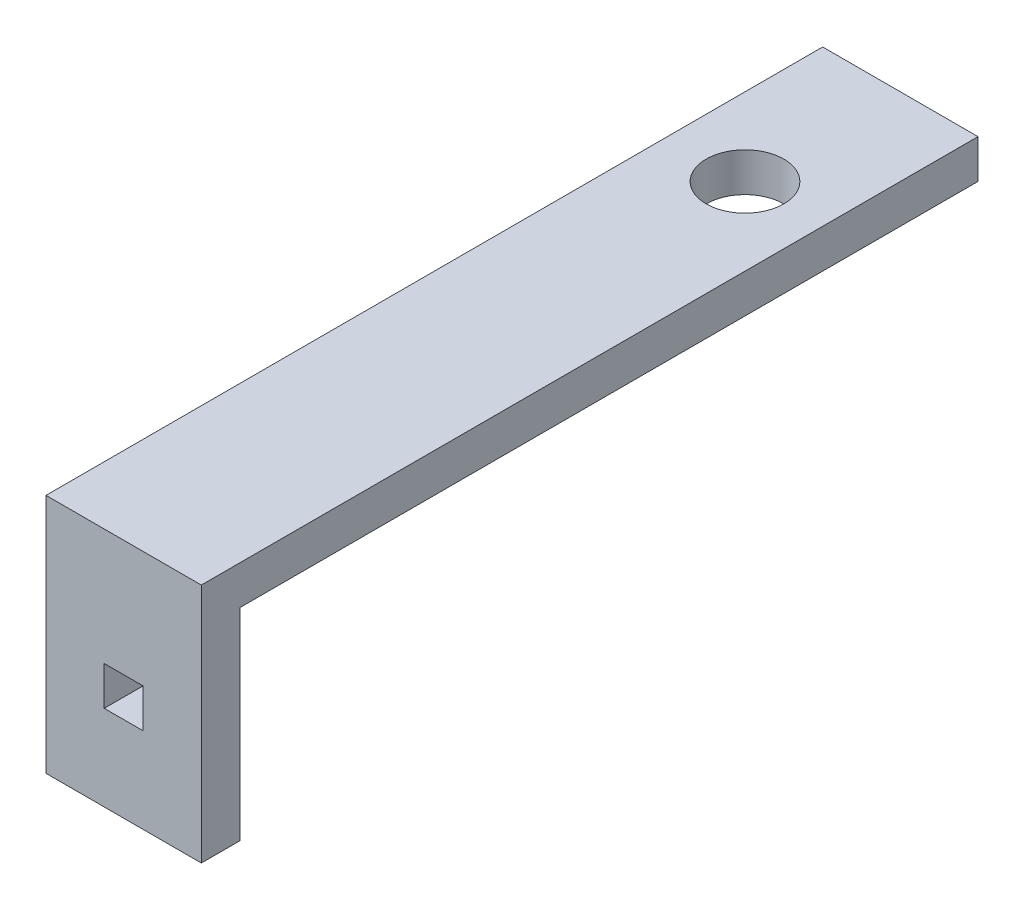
SolidWorks part; units mm, degrees
ref_plane "Front" through (0, 0, 0) normal (0, 0, 1) x (1, 0, 0)
ref_plane "Top" through (0, 0, 0) normal (0, 1, 0) x (1, 0, 0)
ref_plane "Right" through (0, 0, 0) normal (1, 0, 0) x (0, 0, -1)
ref_plane "Plane1" through (12.8097, 0, 0) normal (1, 0, 0) x (0, 0, -1)
sketch "Sketch2" plane through (12.8097, 0, 0) normal (1, 0, 0) x (0, 0, -1)
  line L12 (-24.1608, 8.3082) -> (70.8392, 8.3082)
  line L13 (-24.1608, -17.6911) -> (-24.1608, 8.3082)
  line L14 (-29.1608, -17.6911) -> (-24.1608, -17.6911)
  line L15 (-29.1608, 13.3082) -> (-29.1608, -17.6911)
  line L16 (70.8392, 13.3082) -> (-29.1608, 13.3082)
  line L17 (70.8392, 8.3082) -> (70.8392, 13.3082)
  dimension "D1" = 5
  dimension "D2" = 30.9992
  dimension "D3" = 100
extrude "Boss-Extrude1" add sketch "Sketch2" along normal blind 20 separate body
sketch "Sketch3" plane through (0, 13.3082, 0) normal (0, 1, 0) x (1, 0, 0)
  line L0 (32.8097, 70.8392) -> (12.8097, 70.8392) construction
  circle A0 centre (22.8097, 50.8392) radius 5
  dimension "D2" = 10
  dimension "D1" = 20
  dimension "D3" = 10
extrude "Cut-Extrude1" cut sketch "Sketch3" against normal up to next
sketch "Sketch4" plane through (0, 0, 29.1608) normal (0, 0, 1) x (1, 0, 0)
  line L0 (32.8097, -17.6911) -> (12.8097, -17.6911) construction
  line L1 (20.3097, -1.6911) -> (25.3097, -1.6911)
  line L2 (20.3097, -1.6911) -> (20.3097, -6.6911)
  line L3 (20.3097, -6.6911) -> (25.3097, -6.6911)
  line L4 (25.3097, -1.6911) -> (25.3097, -6.6911)
  line L6 (20.3097, -1.6911) -> (25.3097, -6.6911) construction
  line L7 (32.8097, 13.3082) -> (32.8097, -17.6911) construction
  point P8 (22.8097, -4.1911)
  dimension "D1" = 5
  dimension "D2" = 11
  dimension "D3" = 10
extrude "Cut-Extrude2" cut sketch "Sketch4" against normal up to next
